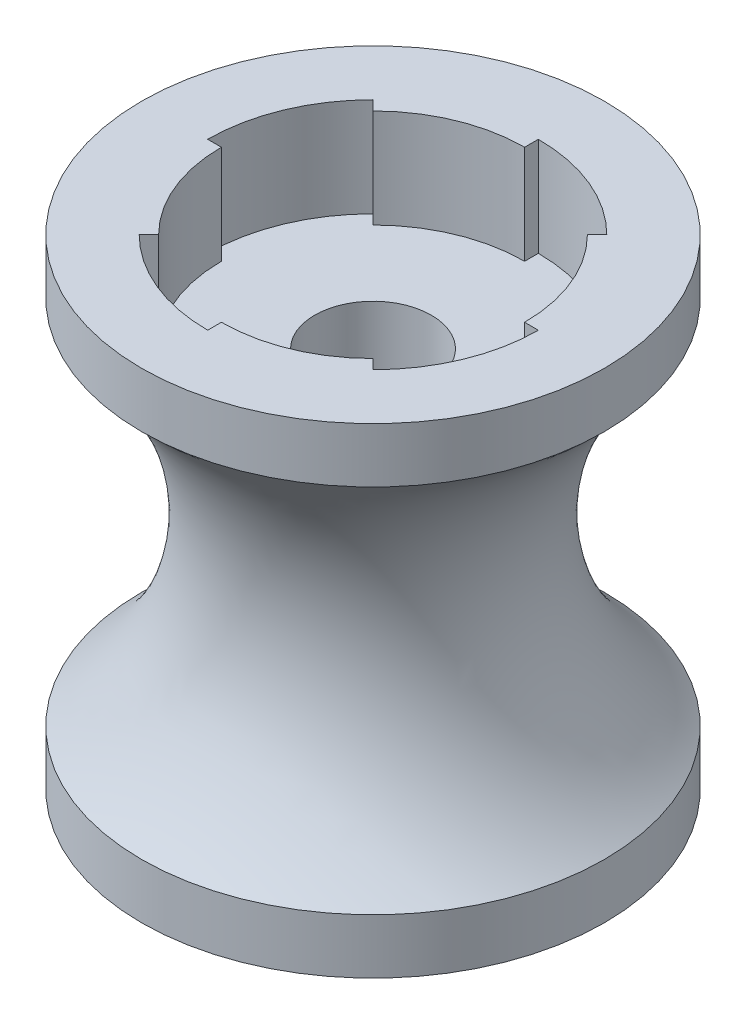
SolidWorks part; units mm, degrees
ref_plane "Plan de face" through (0, 0, 0) normal (0, 0, 1) x (1, 0, 0)
ref_plane "Plan de dessus" through (0, 0, 0) normal (0, 1, 0) x (1, 0, 0)
ref_plane "Plan de droite" through (0, 0, 0) normal (1, 0, 0) x (0, 0, -1)
sketch "Esquisse1" plane through (0, 0, 0) normal (1, 0, 0) x (0, 0, -1)
  line L0 (0, 0) -> (0, 35) construction
  line L3 (0, 0) -> (-16.8645, 0)
  line L4 (0, 0) -> (0, 17.5)
  line L6 (-16.8645, 4) -> (-16.8645, 0)
  line L7 (0, 17.5) -> (-10.5, 17.5)
  arc A1 (-10.5, 17.5) -> (-16.8645, 4) centre (-28, 17.5) cw
  dimension "D1" = 17.5
  dimension "D2" = 17.5
  dimension "D3" = 4
  dimension "D4" = 10.5
revolve "Révolution1" add sketch "Esquisse1" angle 360 about L0
sketch "Esquisse2" plane through (0, 0, 0) normal (0, -1, 0) x (1, 0, 0)
  circle A0 centre (0, 0) radius 4.25
  dimension "D1" = 8.5
extrude "Enlèv. mat.-Extru.1" cut sketch "Esquisse2" against normal blind 87
sketch "Esquisse3" plane through (0, 0, 0) normal (0, -1, 0) x (-1, 0, 0)
  circle A0 centre (0, 0) radius 11.05
  dimension "D1" = 22.1
extrude "Enlèv. mat.-Extru.2" cut sketch "Esquisse3" against normal blind 7.2
sketch "Esquisse4" plane through (0, 0, 0) normal (0, -1, 0) x (1, 0, 0)
  line L0 (0, 0) -> (0, 12.05) construction
  line L1 (-12.05, 0) -> (0, 0) construction
  line L2 (-8.5206, 8.5206) -> (0, 0) construction
  line L3 (-8.5206, 8.5206) -> (-7.8135, 7.8135)
  line L4 (0, 12.05) -> (0, 11.05)
  circle A0 centre (0, 0) radius 11.05 construction
  circle A1 centre (0, 0) radius 12.05 construction
  arc A2 (-12.05, 0) -> (0, 12.05) centre (0, 0) cw construction
  arc A3 (-7.8135, 7.8135) -> (0, 11.05) centre (0, 0) cw
  arc A4 (-8.5206, 8.5206) -> (0, 12.05) centre (0, 0) cw
  dimension "D1" = 22.1
  dimension "D2" = 1
extrude "Enlèv. mat.-Extru.3" cut sketch "Esquisse4" against normal up to surface (7.2 mm away) contours A4 L3 L4 M5
pattern_circular "Répétition circulaire1" count 4 over 360 about axis through (0, 16.7157, 0) along (0, -1, 0) of "Enlèv. mat.-Extru.3"
mirror "Symétrie1" about plane through (0, 17.5, 0) normal (0, -1, 0)
